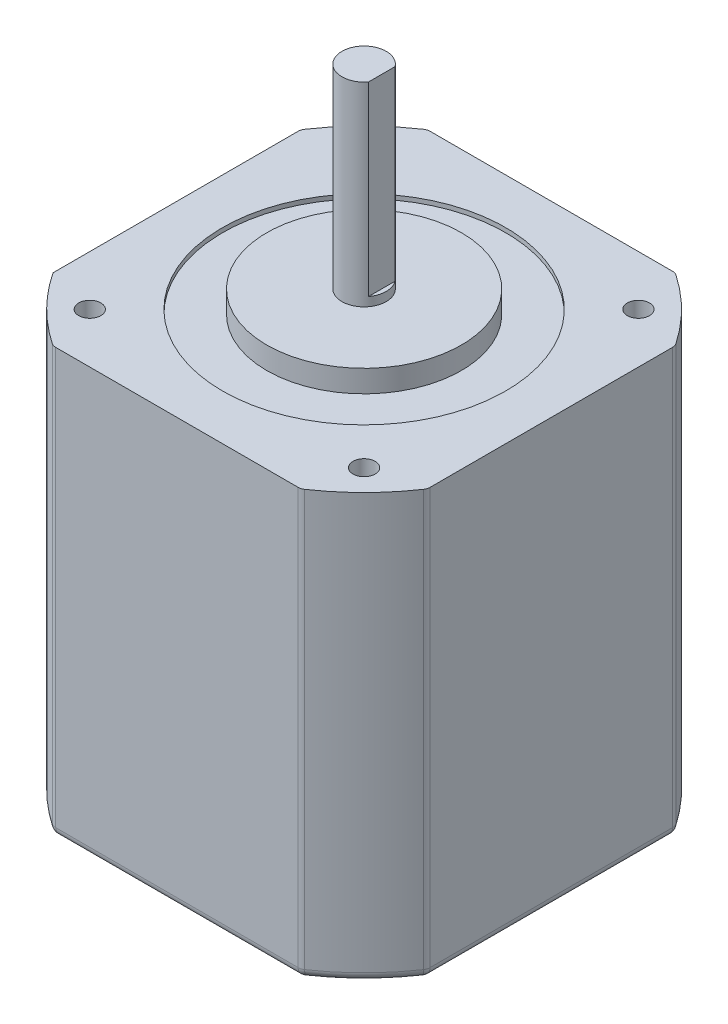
SolidWorks part; units mm, degrees
ref_plane "Front" through (0, 0, 0) normal (0, 0, 1) x (1, 0, 0)
ref_plane "Top" through (0, 0, 0) normal (0, 1, 0) x (1, 0, 0)
ref_plane "Right" through (0, 0, 0) normal (1, 0, 0) x (0, 0, -1)
sketch "Sketch1" plane through (0, 0, 0) normal (0, 1, 0) x (1, 0, 0)
  line L0 (21.15, 0) -> (0, 0) construction
  line L1 (0, 0) -> (0, 21.15) construction
  line L2 (21.15, -13.9997) -> (21.15, 13.9997)
  line L3 (13.9997, -21.15) -> (-13.9997, -21.15)
  line L4 (13.9997, 21.15) -> (-13.9997, 21.15)
  line L5 (-21.15, -13.9997) -> (-21.15, 13.9997)
  arc A0 (13.9997, -21.15) -> (21.15, -13.9997) centre (0, 0) ccw
  arc A1 (13.9997, 21.15) -> (21.15, 13.9997) centre (0, 0) cw
  arc A2 (-13.9997, -21.15) -> (-21.15, -13.9997) centre (0, 0) cw
  arc A3 (-13.9997, 21.15) -> (-21.15, 13.9997) centre (0, 0) ccw
  point P24 (0, -21.15)
  dimension "D1" = 42.3
  dimension "D3" = 27.9995
extrude "Boss-Extrude1" add sketch "Sketch1" along normal blind 48
sketch "Sketch2" plane through (0, 48, 0) normal (0, 1, 0) x (1, 0, 0)
  circle A0 centre (0, 0) radius 11
  dimension "D1" = 22
extrude "boss" add sketch "Sketch2" along normal blind 2
sketch "Sketch3" plane through (0, 50, 0) normal (0, 1, 0) x (1, 0, 0)
  circle A0 centre (0, 0) radius 2.5
  dimension "D1" = 5
extrude "shaft" add sketch "Sketch3" along normal blind 22
sketch "Sketch4" plane through (0, 72, 0) normal (0, 1, 0) x (1, 0, 0)
  line L0 (2, 1.5) -> (2, -1.5)
  line L1 (2, -1.5) -> (2.5, -1.5)
  line L2 (2.5, -1.5) -> (2.5, 1.5)
  line L3 (2.5, 1.5) -> (2, 1.5)
  circle A0 centre (0, 0) radius 2.5 construction
  circle A1 centre (0, 0) radius 2.5 construction
  dimension "D1" = 2
extrude "shaft flat" cut sketch "Sketch4" against normal blind 21
hole_wizard "M3x0.5 Tapped Hole1" positions "Sketch5" profile "Sketch6" tap size "M3x0.5" standard "ANSI Metric"
sketch "Sketch5" plane through (0, 48, 0) normal (0, 1, 0) x (1, 0, 0)
  line L0 (15.5, -15.5) -> (-15.5, -15.5) construction
  line L1 (-15.5, -15.5) -> (-15.5, 15.5) construction
  line L3 (0, 0) -> (-15.5, 0) construction
  line L5 (0, 0) -> (0, -15.5) construction
  line L7 (15.5, -15.5) -> (15.5, 15.5) construction
  point P0 (-15.5, -15.5)
  point P2 (15.5, -15.5)
  point P4 (15.5, 15.5)
  point P6 (-15.5, 15.5)
  dimension "D1" = 31
sketch "Sketch6" plane through (-15.5, 48, 15.5) normal (1, 0, 0) x (0, 0, 1)
  line L0 (0, 0) -> (0, 6.2511)
  line L1 (0, 6.2511) -> (1.25, 5.5)
  line L2 (1.25, 5.5) -> (1.25, 0)
  line L5 (1.25, 0) -> (0, 0)
  line L10 (0, 6.2511) -> (-1.25, 5.5) construction
  line L11 (0, -6.35) -> (0, 107.95) construction
  dimension "Tap Drill Dia." = 2.5
  dimension "Tap Drill Depth" = 5.5
  dimension "Drill Angle" = 118
sketch "Sketch7" plane through (0, 48, 0) normal (0, 1, 0) x (1, 0, 0)
  circle A0 centre (0, 0) radius 16
  circle A1 centre (0, 0) radius 11 construction
  circle A2 centre (0, 0) radius 11
  dimension "D1" = 32
extrude "mounting face relief" cut sketch "Sketch7" against normal blind 0.5
fillet "Fillet1" radius 1 15 edges at (0, 0, -21.15) (-17.9348, 0, -17.9348) (-21.15, 0, 0) (-17.9348, 0, 17.9348) (0, 0, 21.15) (17.9348, 0, 17.9348) (21.15, 0, 0) (17.9348, 0, -17.9348) (-21.15, 24, -13.9997) (-13.9997, 24, -21.15) (13.9997, 24, -21.15) (21.15, 24, -13.9997) (21.15, 24, 13.9997) (13.9997, 24, 21.15) (-13.9997, 24, 21.15)
